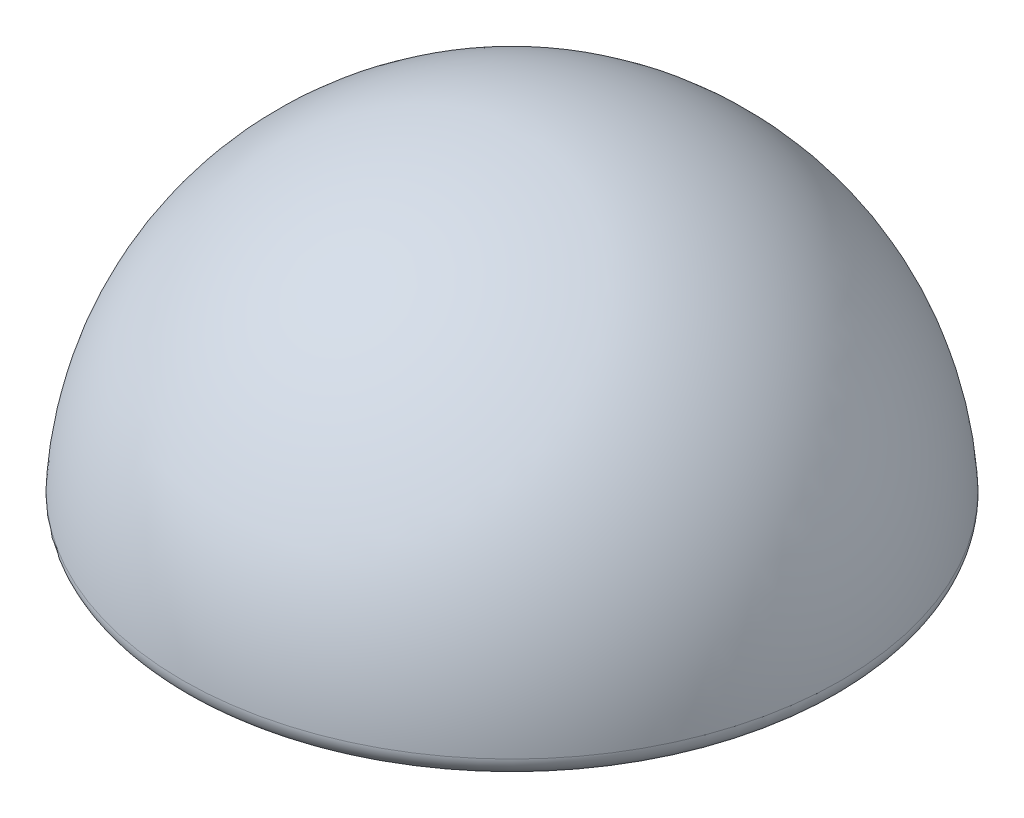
SolidWorks part; units mm, degrees
ref_plane "Front Plane" through (0, 0, 0) normal (0, 0, 1) x (1, 0, 0)
ref_plane "Top Plane" through (0, 0, 0) normal (0, 1, 0) x (1, 0, 0)
ref_plane "Right Plane" through (0, 0, 0) normal (1, 0, 0) x (0, 0, -1)
sketch "Sketch1" plane through (0, 0, 0) normal (0, 0, 1) x (1, 0, 0)
  line L0 (0, 0) -> (0, 35)
  line L1 (0, 0) -> (35, 0)
  arc A0 (0, 35) -> (35, 0) centre (0, 0) cw
  dimension "D1" = 35
  dimension "D2" = 35
revolve "Revolve1" add sketch "Sketch1" angle 360 about L0
sketch "Sketch2" plane through (0, 0, 0) normal (0, -1, 0) x (1, 0, 0)
  circle A0 centre (0, 0) radius 12.25
  dimension "D1" = 24.5
extrude "Cut-Extrude1" cut sketch "Sketch2" against normal blind 16
fillet "Fillet1" radius 2 1 edges at (0, 0, -35)
